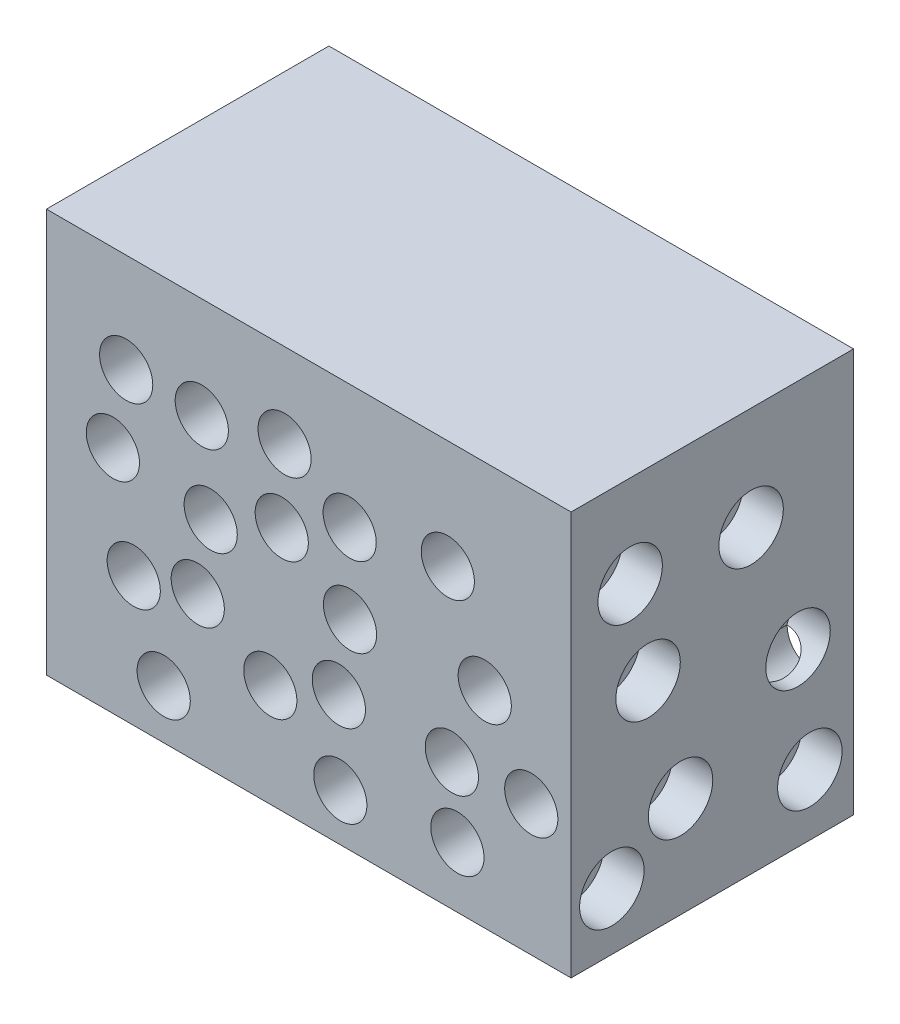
SolidWorks part; units mm, degrees
ref_plane "Front Plane" through (0, 0, 0) normal (0, 0, 1) x (1, 0, 0)
ref_plane "Top Plane" through (0, 0, 0) normal (0, 1, 0) x (1, 0, 0)
ref_plane "Right Plane" through (0, 0, 0) normal (1, 0, 0) x (0, 0, -1)
sketch "Sketch1" plane through (0, 0, 0) normal (0, 0, 1) x (1, 0, 0)
  line L0 (0, 0) -> (0, 27.8347) construction
  line L1 (-65, 50) -> (65, 50)
  line L2 (-65, 50) -> (-65, -50)
  line L3 (-65, -50) -> (65, -50)
  line L4 (65, 50) -> (65, -50)
  line L5 (0, 0) -> (27.3045, 0) construction
  dimension "D1" = 130
  dimension "D2" = 65
  dimension "D3" = 50
  dimension "D4" = 50
extrude "Boss-Extrude1" add sketch "Sketch1" along normal blind 70
sketch "Sketch2" plane through (0, 0, 70) normal (0, 0, 1) x (1, 0, 0)
  circle A0 centre (-45.242, 25.4152) radius 6.5909
  circle A1 centre (-24.2993, 3.7414) radius 6.5909
  circle A2 centre (-5.9906, 29.108) radius 6.5909
  circle A3 centre (-43.3649, -17.8567) radius 6.5909
  circle A4 centre (10.2239, -0.4571) radius 6.5909
  circle A5 centre (-9.5265, -24.4965) radius 6.5909
  circle A6 centre (35.4613, -18.4268) radius 6.5909
  circle A7 centre (34.4568, 23.0509) radius 6.5909
  circle A8 centre (10.1394, 19.2601) radius 6.5909
  circle A9 centre (43.6119, 0.997) radius 6.5909
  circle A10 centre (7.8174, -38.2721) radius 6.5909
  circle A11 centre (-35.9418, -37.7608) radius 6.5909
  circle A12 centre (36.8368, -34.9862) radius 6.5909
  circle A13 centre (55.139, -17.5543) radius 6.5909
  circle A14 centre (7.4603, -17.9446) radius 6.5909
  circle A15 centre (-27.5024, -13.7991) radius 6.5909
  circle A16 centre (-48.5395, 7.036) radius 6.5909
  circle A17 centre (-26.5023, 24.9185) radius 6.5909
  circle A18 centre (-6.6887, 10.7975) radius 6.5909
extrude "Cut-Extrude1" cut sketch "Sketch2" against normal through all
sketch "Sketch3" plane through (65, 0, 0) normal (1, 0, 0) x (0, 0, -1)
  circle A0 centre (-55.3593, 27.2614) radius 7.9864
  circle A1 centre (-50.9187, 4.2739) radius 7.9864
  circle A2 centre (-25.3855, 24.3857) radius 7.9864
  circle A3 centre (-13.7577, -7.5692) radius 7.9864
  circle A4 centre (-42.8721, -25.0394) radius 7.9864
  circle A5 centre (-10.8376, -34.8545) radius 7.9864
  circle A6 centre (-59.8943, -35.8615) radius 7.9864
extrude "Cut-Extrude2" cut sketch "Sketch3" against normal blind 10
sketch "Sketch4" plane through (0, -50, 0) normal (0, -1, 0) x (1, 0, 0)
  line L0 (0, 0) -> (0, 70) construction
  line L1 (-65, 70) -> (65, 70) construction
  line L2 (0, 60) -> (0, 10) construction
  line L3 (-40, 10) -> (40, 10)
  line L4 (-50, 20) -> (-50, 50)
  line L5 (-40, 60) -> (40, 60)
  line L6 (50, 20) -> (50, 50)
  arc A0 (40, 10) -> (50, 20) centre (40, 20) ccw
  arc A1 (-40, 10) -> (-50, 20) centre (-40, 20) cw
  arc A2 (-50, 50) -> (-40, 60) centre (-40, 50) cw
  arc A3 (40, 60) -> (50, 50) centre (40, 50) cw
  dimension "D4" = 10
  dimension "D1" = 50
  dimension "D2" = 10
  dimension "D3" = 10
extrude "Cut-Extrude3" cut sketch "Sketch4" against normal blind 5
